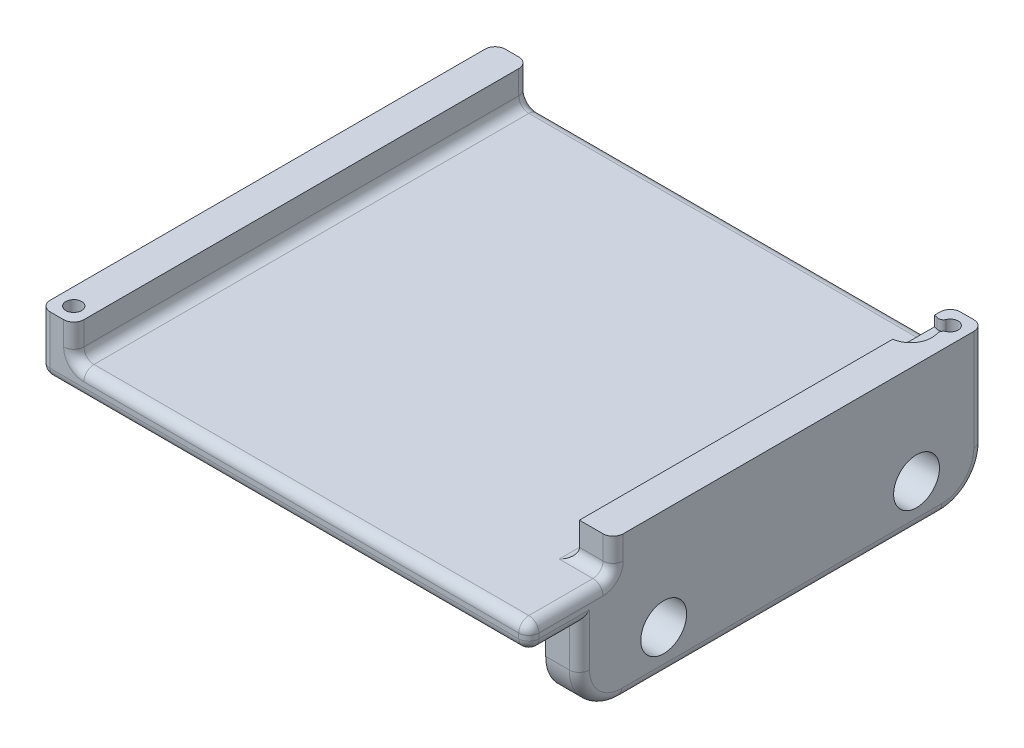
SolidWorks part; units mm, degrees
ref_plane "Front Plane" through (0, 0, 0) normal (0, 0, 1) x (1, 0, 0)
ref_plane "Top Plane" through (0, 0, 0) normal (0, 1, 0) x (1, 0, 0)
ref_plane "Right Plane" through (0, 0, 0) normal (1, 0, 0) x (0, 0, -1)
sketch "Sketch1" plane through (0, 0, 0) normal (0, 1, 0) x (1, 0, 0)
  line L1 (-18.415, -17.145) -> (18.415, -17.145)
  line L2 (-18.415, -17.145) -> (-18.415, 17.145)
  line L3 (-18.415, 17.145) -> (18.415, 17.145)
  line L4 (18.415, -17.145) -> (18.415, 17.145)
  line L5 (-18.415, -17.145) -> (18.415, 17.145) construction
  line L6 (-18.415, 17.145) -> (18.415, -17.145) construction
  point P0 (0, 0)
  dimension "D1" = 36.83
  dimension "D2" = 34.29
extrude "Boss-Extrude1" add sketch "Sketch1" along normal blind 1.905
sketch "Sketch6" plane through (18.415, 0, 0) normal (1, 0, 0) x (0, 0, -1)
  line L0 (-17.145, 0) -> (17.145, 0) construction
  line L1 (-13.335, 0) -> (17.145, 0)
  line L2 (-13.335, 0) -> (-13.335, -6.35)
  line L3 (-13.335, -6.35) -> (17.145, -6.35)
  line L4 (17.145, 0) -> (17.145, -6.35)
  line L6 (17.145, 1.905) -> (17.145, 0) construction
  dimension "D1" = 6.35
  dimension "D3" = 30.48
extrude "Boss-Extrude3" add sketch "Sketch6" against normal blind 2.54
hole_wizard "#29 (0.136) Diameter Hole1" positions "Sketch7" profile "Sketch8" hole size "#29" standard "ANSI Inch"
sketch "Sketch7" plane through (18.415, 0, 0) normal (1, 0, 0) x (0, 0, -1)
  line L0 (-6.985, -3.175) -> (12.065, -3.175) construction
  line L2 (-13.335, -6.35) -> (17.145, -6.35) construction
  line L3 (-6.985, 0) -> (-6.985, -6.35) construction
  line L4 (17.145, 1.905) -> (17.145, -6.35) construction
  point P0 (12.065, -3.175)
  point P2 (-6.985, -3.175)
  dimension "D1" = 19.05
  dimension "D2" = 5.08
sketch "Sketch8" plane through (18.415, -3.175, -12.065) normal (0, 1, 0) x (0, 0, -1)
  line L0 (0, 0) -> (0, 36.83)
  line L1 (0, 36.83) -> (1.7272, 36.83)
  line L2 (1.7272, 36.83) -> (1.7272, 0)
  line L5 (1.7272, 0) -> (0, 0)
  line L11 (0, -6.35) -> (0, 107.95) construction
  dimension "Thru Hole Dia." = 3.4544
  dimension "Thru Hole Depth" = 36.83
fillet "Fillet1" radius 3.175 2 edges at (17.145, -6.35, -17.145) (17.145, -6.35, 13.335)
sketch "Sketch2" plane through (0, 1.905, 0) normal (0, 1, 0) x (1, 0, 0)
  line L0 (18.415, -10.795) -> (15.875, -10.795)
  line L2 (-18.415, -17.145) -> (-18.415, 17.145)
  line L4 (18.415, -10.795) -> (18.415, 17.145)
  line L10 (-15.875, -17.145) -> (-15.875, 17.145)
  line L12 (15.875, -10.795) -> (15.875, 17.145)
  line L13 (-18.415, -17.145) -> (18.415, -17.145) construction
  line L14 (18.415, 17.145) -> (-18.415, 17.145) construction
  line L15 (-18.415, 17.145) -> (-15.875, 17.145)
  line L16 (-18.415, -17.145) -> (-15.875, -17.145)
  line L17 (15.875, 17.145) -> (18.415, 17.145)
  line L18 (-18.415, 17.145) -> (-18.415, -17.145) construction
  point P4 (0, 0)
  dimension "D1" = 2.54
  dimension "D3" = 2.54
  dimension "D4" = 27.94
extrude "Boss-Extrude2" add sketch "Sketch2" along normal blind 2.54
hole_wizard "#0-80 Tapped Hole1" positions "Sketch3" profile "Sketch4" tap size "#0-80" standard "ANSI Inch"
sketch "Sketch3" plane through (0, 4.445, 0) normal (0, 1, 0) x (1, 0, 0)
  line L1 (17.145, -15.875) -> (-17.145, -15.875) construction
  line L2 (17.145, -15.875) -> (17.145, 15.875) construction
  line L3 (17.145, 15.875) -> (-17.145, 15.875) construction
  line L4 (-17.145, -15.875) -> (-17.145, 15.875) construction
  line L5 (17.145, -15.875) -> (-17.145, 15.875) construction
  line L6 (17.145, 15.875) -> (-17.145, -15.875) construction
  point P0 (-17.145, -15.875)
  point P2 (17.145, 15.875)
  dimension "D1" = 34.29
  dimension "D2" = 31.75
sketch "Sketch4" plane through (-17.145, 4.445, 15.875) normal (1, 0, 0) x (0, 0, 1)
  line L0 (0, 0) -> (0, 10.795)
  line L1 (0, 10.795) -> (0.5956, 10.795)
  line L2 (0.5956, 10.795) -> (0.5956, 0)
  line L5 (0.5956, 0) -> (0, 0)
  line L11 (0, -6.35) -> (0, 107.95) construction
  dimension "Thru Tap Drill Dia." = 1.1913
  dimension "Thru Tap Drill Depth" = 10.795
sketch "Sketch9" plane through (0, 4.445, 0) normal (0, 1, 0) x (1, 0, 0)
  line L0 (15.6552, 14.3852) -> (17.145, 15.875) construction
  line L1 (18.415, -10.795) -> (18.415, 17.145) construction
  circle A2 centre (15.6552, 14.3852) radius 1.5875
  circle A7 centre (17.145, 15.875) radius 0.5956 construction
  dimension "D1" = 3.175
  dimension "D3" = 0.0762
  dimension "D2" = 45
extrude "Cut-Extrude2" cut sketch "Sketch9" against normal blind 0.762
fillet "Fillet2" radius 0.762 18 edges at (18.415, -1.5875, 13.335) (18.415, -5.4201, 12.4051) (18.415, -6.35, -1.905) (18.415, -5.4201, -16.2151) (-18.415, 2.2225, 17.145) (18.415, 0.9525, 17.145) (-18.415, 2.2225, -17.145) (18.415, 0.635, -17.145) (18.415, 3.175, 10.795) (-15.875, 3.175, 17.145) (-15.875, 3.175, -17.145) (15.875, 3.175, -17.145) (17.145, 1.905, 10.795) (18.415, 1.905, 13.97) (1.27, 1.905, 17.145) (-15.875, 1.905, 0) (0, 1.905, -17.145) (15.875, 1.905, -3.175)
fillet "Fillet3" radius 0.381 2 edges at (16.9418, 4.064, -15.3151) (16.5851, 4.064, -15.6718)
fillet "Fillet4" radius 0.762 4 edges at (18.415, 0, 14.478) (-0.889, 0, -17.145) (0, 0, 17.145) (-18.415, 0, 0)
